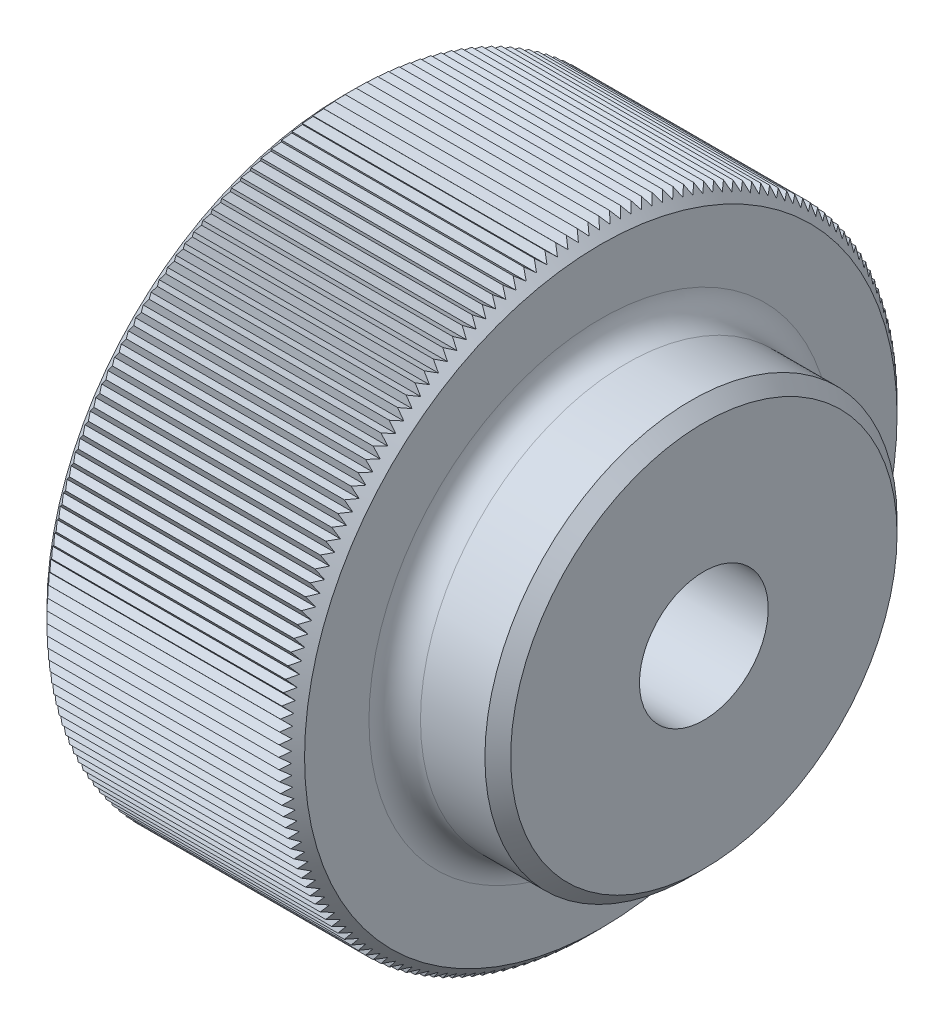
SolidWorks part; units mm, degrees
ref_plane "Front Plane" through (0, 0, 0) normal (0, 0, 1) x (1, 0, 0)
ref_plane "Top Plane" through (0, 0, 0) normal (0, 1, 0) x (1, 0, 0)
ref_plane "Right Plane" through (0, 0, 0) normal (1, 0, 0) x (0, 0, -1)
sketch "Sketch1" plane through (0, 0, 0) normal (1, 0, 0) x (0, 0, -1)
  circle A0 centre (0, 0) radius 12
  dimension "D1" = 24
extrude "Extrude1" add sketch "Sketch1" against normal blind 10
chamfer "Chamfer1" distance 0.5 angle 45 2 edges at (-10, 0, -12) (0, 0, -12)
sketch "Sketch2" plane through (0, 0, 0) normal (1, 0, 0) x (0, 0, -1)
  line L0 (0, 0) -> (0, 50000) construction
  line L1 (0, 0) -> (-872.6203, 49992.3848) construction
  line L2 (0, 12) -> (-0.2051, 11.75)
  line L3 (-0.4188, 11.9927) -> (-0.2051, 11.75)
  circle A0 centre (0, 0) radius 12 construction
  arc A1 (-0.4188, 11.9927) -> (0, 12) centre (-0.2125, 12.1743) cw
  dimension "D1" = 1
  dimension "D2" = 0.25
extrude "Extrude2" cut sketch "Sketch2" against normal through all
pattern_circular "CirPattern1" count 180 over 360 about axis through (0, 0, 0) along (1, 0, 0) of "Extrude2"
sketch "Sketch3" plane through (0, 0, 0) normal (1, 0, 0) x (0, 0, -1)
  circle A0 centre (0, 0) radius 8
  dimension "D1" = 16
extrude "Extrude3" add sketch "Sketch3" along normal blind 4
fillet "Fillet1" radius 1 1 edges at (0, 0, -8)
sketch "Sketch4" plane through (-10, 0, 0) normal (-1, 0, 0) x (0, 0, 1)
  circle A0 centre (0, 0) radius 2.5
  dimension "D1" = 5
extrude "Extrude4" cut sketch "Sketch4" against normal through all
sketch "Sketch5" plane through (-10, 0, 0) normal (-1, 0, 0) x (0, 0, 1)
  circle A0 centre (0, 0) radius 9
  dimension "D1" = 18
extrude "Extrude5" cut sketch "Sketch5" against normal blind 6
chamfer "Chamfer2" distance 0.5 angle 45 3 edges at (-10, 0, 9) (4, 0, -8) (-4, 0, 2.5)
sketch "Sketch6" plane through (0, 0, 0) normal (0, 0, 1) x (1, 0, 0)
  line L0 (4, -7.5) -> (4, 7.5) construction
  circle A0 centre (1.5, 0) radius 0.7
  dimension "D1" = 1.4
  dimension "D2" = 2.5
extrude "Extrude6" [suppressed] cut sketch "Sketch6" along normal through all
